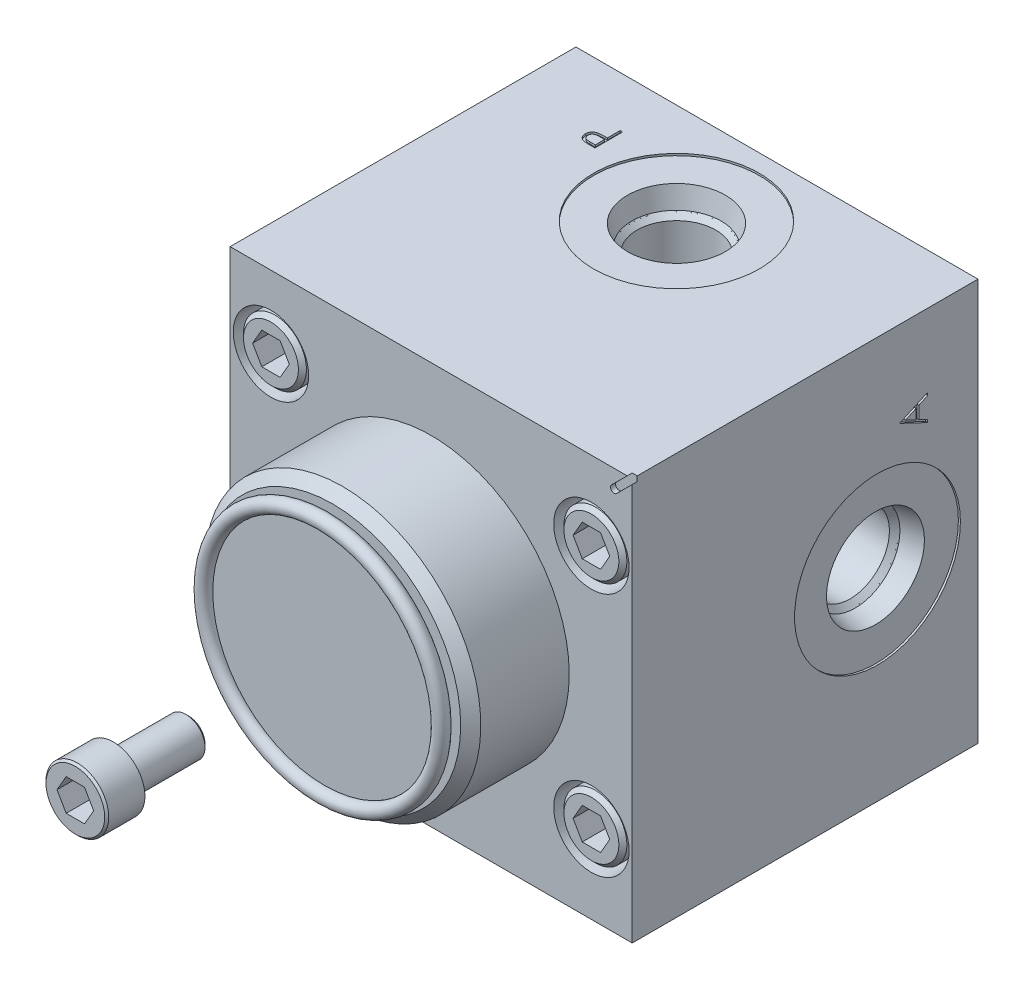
SolidWorks part; units mm, degrees
ref_plane "Front Plane" through (0, 0, 0) normal (0, 0, 1) x (1, 0, 0)
ref_plane "Top Plane" through (0, 0, 0) normal (0, 1, 0) x (1, 0, 0)
ref_plane "Right Plane" through (0, 0, 0) normal (1, 0, 0) x (0, 0, -1)
imported_body "Surface-Imported1"
imported_body "Surface-Imported2"
imported_body "Surface-Imported3"
imported_body "Surface-Imported4"
imported_body "Surface-Imported5"
imported_body "Surface-Imported6"
imported_body "Surface-Imported7"
imported_body "Surface-Imported8"
imported_body "Surface-Imported9"
imported_body "Surface-Imported10"
imported_body "Surface-Imported11"
imported_body "Surface-Imported12"
imported_body "Imported1"
imported_body "Imported2"
sketch "Sketch1" plane through (0, 0, 0) normal (1, 0, 0) x (0, 0, -1)
  line L0 (0, 0) -> (-43.688, 0) construction
  line L1 (0, 0) -> (0, 50.8) construction
  text T0 "<r90>A</r>"
  dimension "D1" = 38.1
  dimension "D2" = 6.35
extrude "Cut-Extrude1" cut sketch "Sketch1" against normal blind 0.254
sketch "Sketch2" plane through (0, 50.8, 0) normal (0, 1, 0) x (1, 0, 0)
  line L0 (0, -43.053) -> (0, 0) construction
  line L1 (0, 0) -> (-50.8, 0) construction
  text T0 "<r180>P</r>"
  dimension "D1" = 38.1
  dimension "D2" = 6.35
extrude "Cut-Extrude2" cut sketch "Sketch2" against normal blind 0.254
sketch "Sketch3" plane through (-50.8, 0, 0) normal (-1, 0, 0) x (0, 0, 1)
  line L0 (43.688, 50.8) -> (0, 50.8) construction
  line L1 (0, 50.8) -> (0, 0) construction
  text T0 "<r-90>B</r>"
  dimension "D1" = 38.1
  dimension "D2" = 6.35
extrude "Cut-Extrude3" cut sketch "Sketch3" against normal blind 0.254
sketch "Sketch4" plane through (0, 0, 0) normal (0, -1, 0) x (1, 0, 0)
  line L0 (-50.8, 43.688) -> (-50.8, 0) construction
  line L1 (-50.8, 0) -> (0, 0) construction
  text T0 "T"
  dimension "D1" = 38.1
  dimension "D2" = 6.35
extrude "Cut-Extrude4" cut sketch "Sketch4" against normal blind 0.254
